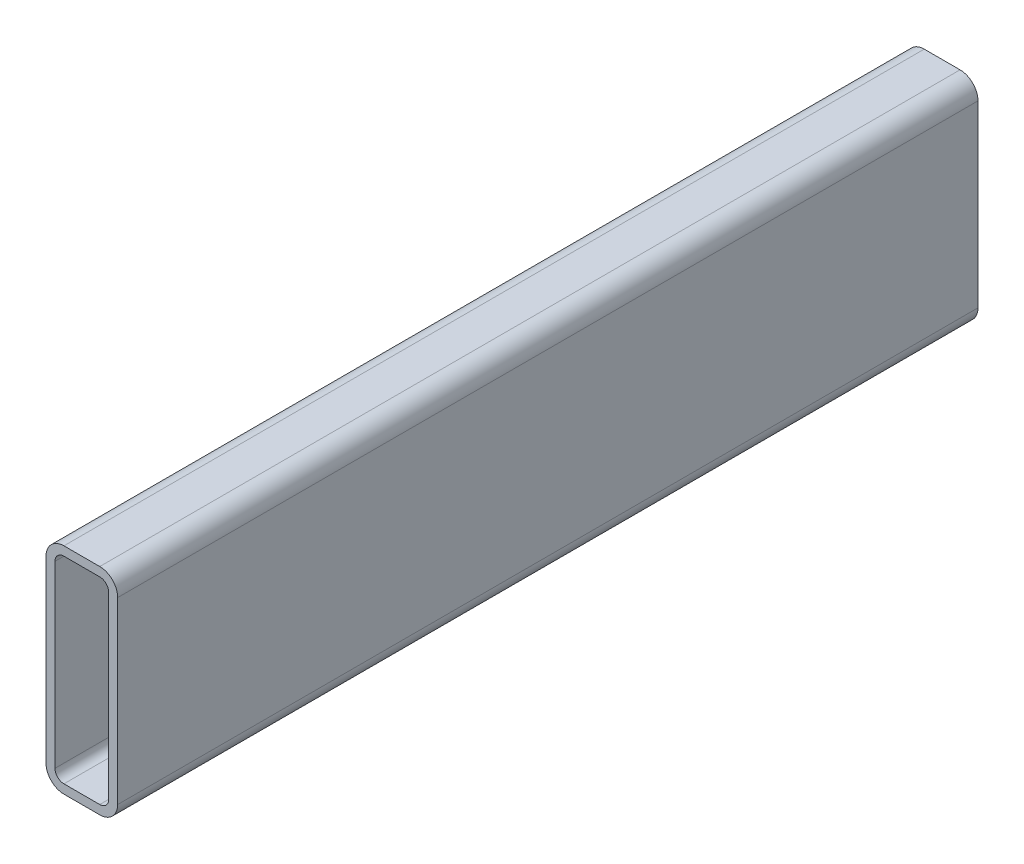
SolidWorks part; units mm, degrees
ref_plane "Front Plane" through (0, 0, 0) normal (0, 0, 1) x (1, 0, 0)
ref_plane "Top Plane" through (0, 0, 0) normal (0, 1, 0) x (1, 0, 0)
ref_plane "Right Plane" through (0, 0, 0) normal (1, 0, 0) x (0, 0, -1)
sketch "Sketch1" plane through (0, 0, 0) normal (0, 0, 1) x (1, 0, 0)
  line B0 (6.35, 73.025) -> (19.05, 73.025)
  arc B1 (22.225, 69.85) -> (19.05, 73.025) centre (19.05, 69.85) ccw
  line B2 (22.225, 69.85) -> (22.225, 6.35)
  arc B3 (19.05, 3.175) -> (22.225, 6.35) centre (19.05, 6.35) ccw
  line B4 (19.05, 3.175) -> (6.35, 3.175)
  arc B5 (3.175, 6.35) -> (6.35, 3.175) centre (6.35, 6.35) ccw
  line B6 (3.175, 6.35) -> (3.175, 69.85)
  arc B7 (6.35, 73.025) -> (3.175, 69.85) centre (6.35, 69.85) ccw
  line B8 (6.35, 76.2) -> (19.05, 76.2)
  arc B9 (25.4, 69.85) -> (19.05, 76.2) centre (19.05, 69.85) ccw
  line B10 (25.4, 69.85) -> (25.4, 6.35)
  arc B11 (19.05, 0) -> (25.4, 6.35) centre (19.05, 6.35) ccw
  line B12 (19.05, 0) -> (6.35, 0)
  arc B13 (0, 6.35) -> (6.35, 0) centre (6.35, 6.35) ccw
  line B14 (0, 6.35) -> (0, 69.85)
  arc B15 (6.35, 76.2) -> (0, 69.85) centre (6.35, 69.85) ccw
sketch_block_instance "HSS3x1x0.125-1"
sketch_block "HSS3x1x0.125"
extrude "Boss-Extrude1" add sketch "Sketch1" along normal blind 304.8
